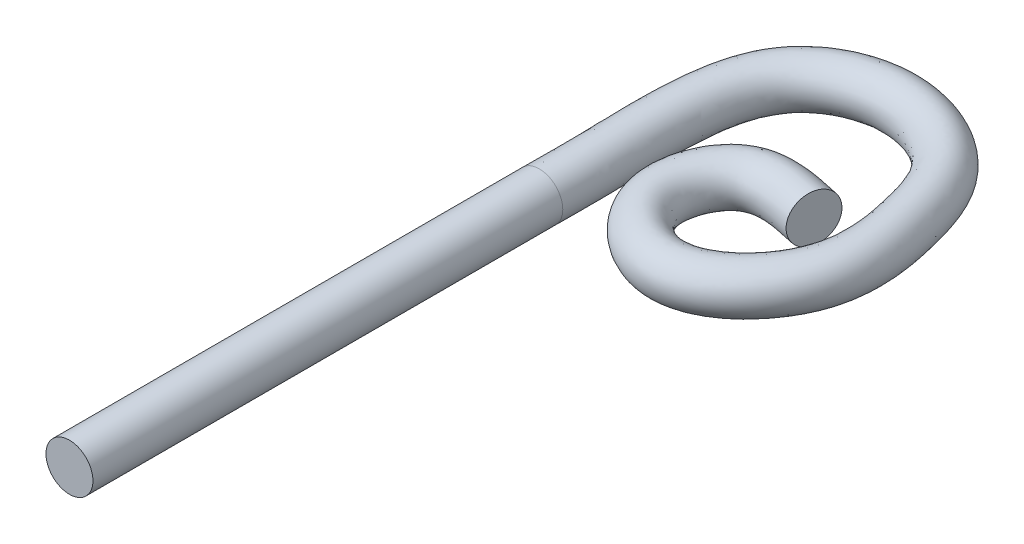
SolidWorks part; units mm, degrees
ref_plane "Plan de face" through (0, 0, 0) normal (0, 0, 1) x (1, 0, 0)
ref_plane "Plan de dessus" through (0, 0, 0) normal (0, 1, 0) x (1, 0, 0)
ref_plane "Plan de droite" through (0, 0, 0) normal (1, 0, 0) x (0, 0, -1)
sketch "Esquisse1" plane through (0, 0, 0) normal (0, 0, 1) x (1, 0, 0)
  circle A0 centre (0, 0) radius 0.5
  dimension "D1" = 1
sketch "Esquisse2" plane through (0, 0, 0) normal (0, 1, 0) x (1, 0, 0)
  line L0 (0, 0) -> (0, 10)
  point P3 (0, 11.129)
  point P4 (0, 13.0554)
  point P5 (0.4801, 14.7506)
  point P6 (1.8671, 15.5211)
  point P7 (3.8706, 14.7506)
  point P8 (4.41, 13.5177)
  point P9 (4.41, 11.3602)
  point P10 (2.6377, 10)
  point P11 (1.3277, 11.129)
  point P12 (1.8671, 12.516)
  point P13 (3.3312, 12.516)
sweep "Balayage1" add profiles "Esquisse1" path "Esquisse2"
